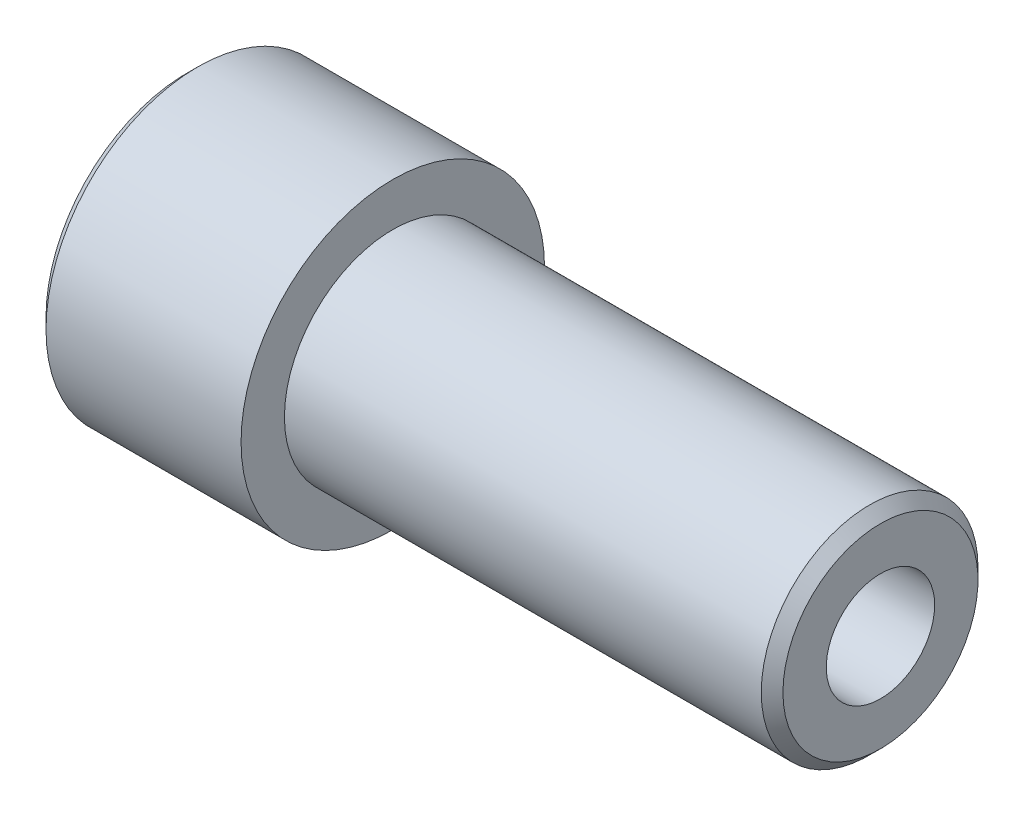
SolidWorks part; units mm, degrees
ref_plane "Plan de face" through (0, 0, 0) normal (0, 0, 1) x (1, 0, 0)
ref_plane "Plan de dessus" through (0, 0, 0) normal (0, 1, 0) x (1, 0, 0)
ref_plane "Plan de droite" through (0, 0, 0) normal (1, 0, 0) x (0, 0, -1)
sketch "Esquisse1" plane through (0, 0, 0) normal (0, 0, 1) x (1, 0, 0)
  line L0 (0, 0) -> (0, 7)
  line L1 (0, 7) -> (9.5, 7)
  line L2 (9.5, 7) -> (9.5, 5)
  line L3 (9.5, 5) -> (32, 5)
  line L4 (32, 5) -> (32, 0)
  line L5 (0, 0) -> (32, 0) construction
  line L6 (0, 0) -> (32, 0)
  dimension "D1" = 10
  dimension "D2" = 14
  dimension "D3" = 22.5
  dimension "D4" = 32
revolve "Révolution1" add sketch "Esquisse1" angle 360 about L5
hole_wizard "Trou taraudé M61" positions "Esquisse3" profile "Esquisse2" tap size "M6" standard "ISO"
sketch "Esquisse3" plane through (32, 0, 0) normal (1, 0, 0) x (0, 0, -1)
  point P0 (0, 0)
sketch "Esquisse2" plane through (32, 0, 0) normal (0, 1, 0) x (0, 0, -1)
  line L0 (0, 0) -> (0, 21.5022)
  line L1 (0, 21.5022) -> (2.5, 20)
  line L2 (2.5, 20) -> (2.5, 0)
  line L5 (2.5, 0) -> (0, 0)
  line L10 (0, 21.5022) -> (-2.5, 20) construction
  line L11 (0, -6.35) -> (0, 107.95) construction
  dimension "Diamètre du trou pour taraudage" = 5
  dimension "Profondeur du trou pour taraudage" = 20
  dimension "Angle de pointe" = 118
chamfer "Chanfrein1" distance 0.5 angle 45 2 edges at (32, 0, 5) (0, 0, 7)
